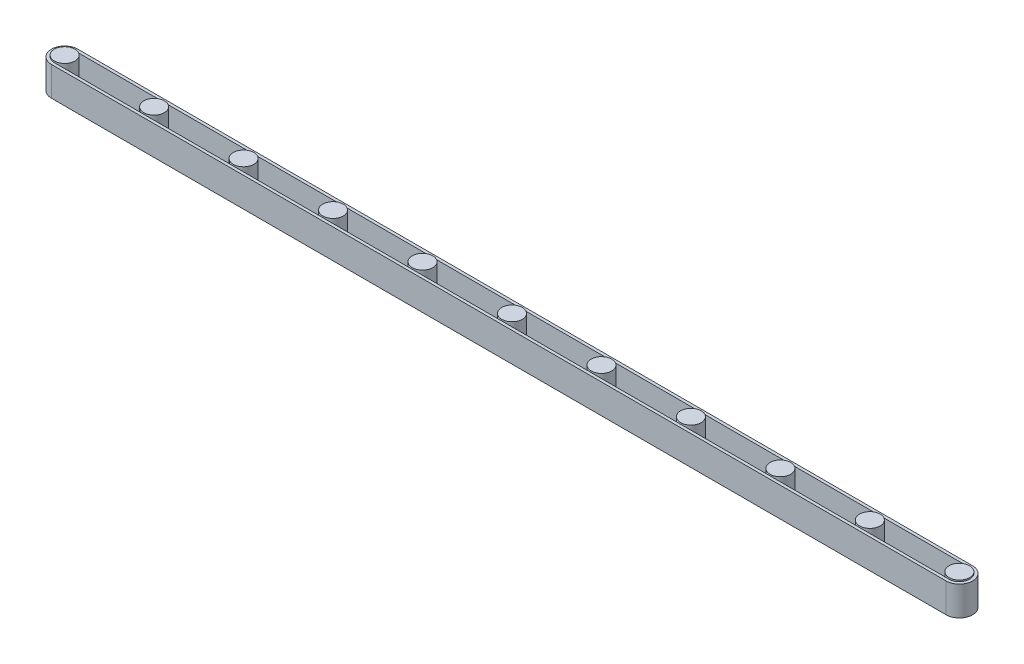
SolidWorks part; units mm, degrees
ref_plane "Front Plane" through (0, 0, 0) normal (0, 0, 1) x (1, 0, 0)
ref_plane "Top Plane" through (0, 0, 0) normal (0, 1, 0) x (1, 0, 0)
ref_plane "Right Plane" through (0, 0, 0) normal (1, 0, 0) x (0, 0, -1)
sketch "Sketch1" plane through (0, 0, 0) normal (0, 1, 0) x (1, 0, 0)
  line L0 (0, 0) -> (305, 0) construction
  line L1 (305, 0) -> (610, 0) construction
  line L2 (610, 0) -> (915, 0) construction
  line L3 (915, 0) -> (1220, 0) construction
  line L4 (1220, 0) -> (1525, 0) construction
  line L5 (1525, 0) -> (1830, 0) construction
  line L6 (1830, 0) -> (2135, 0) construction
  line L7 (2135, 0) -> (2440, 0) construction
  line L8 (2440, 0) -> (2745, 0) construction
  line L9 (2745, 0) -> (3050, 0) construction
  circle A0 centre (0, 0) radius 35
  circle A1 centre (3050, 0) radius 35
  circle A2 centre (305, 0) radius 35
  circle A3 centre (610, 0) radius 35
  circle A4 centre (915, 0) radius 35
  circle A5 centre (1220, 0) radius 35
  circle A6 centre (1830, 0) radius 35
  circle A7 centre (1525, 0) radius 35
  circle A8 centre (2135, 0) radius 35
  circle A9 centre (2440, 0) radius 35
  circle A10 centre (2745, 0) radius 35
  dimension "D1" = 70
  dimension "D2" = 3050
extrude "Boss-Extrude1" add sketch "Sketch1" along normal mid plane 110
sketch "Sketch2" plane through (0, 0, 0) normal (0, 1, 0) x (1, 0, 0)
  line L0 (0, 35) -> (3050, 35)
  line L1 (0, -35) -> (3050, -35)
  line L2 (0, 45) -> (3050, 45)
  line L3 (0, -45) -> (3050, -45)
  circle A0 centre (3050, 0) radius 35 construction
  circle A1 centre (0, 0) radius 35
  arc A2 (0, 35) -> (0, -35) centre (0, 0) ccw
  circle A3 centre (3050, 0) radius 35
  arc A4 (3050, -35) -> (3050, 35) centre (3050, 0) ccw
  arc A5 (3050, -45) -> (3050, 45) centre (3050, 0) ccw
  arc A6 (0, 45) -> (0, -45) centre (0, 0) ccw
  dimension "D1" = 0
  dimension "D2" = 0
  dimension "D3" = 10
extrude "Boss-Extrude2" add sketch "Sketch2" along normal mid plane 100 separate body
